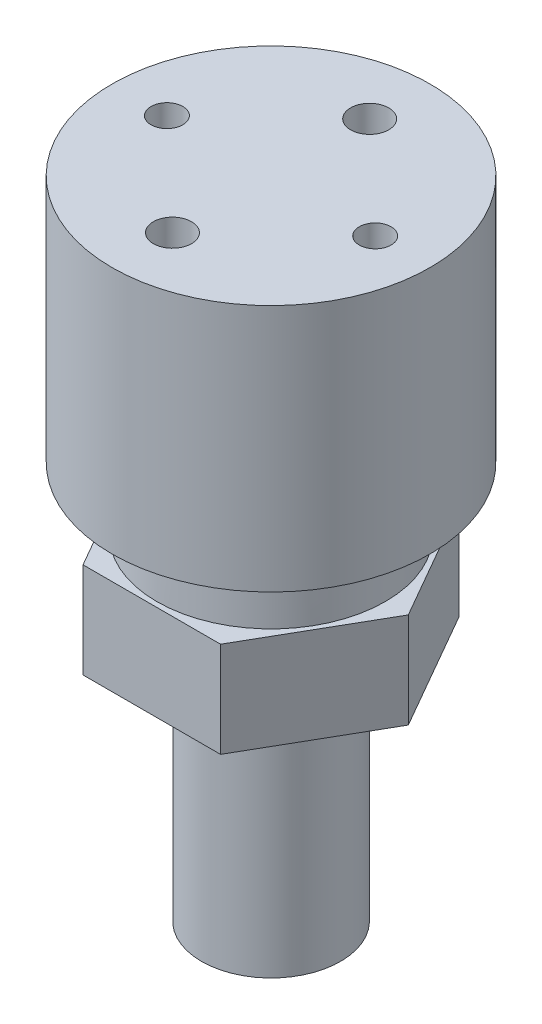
SolidWorks part; units mm, degrees
ref_plane "Front" through (0, 0, 0) normal (0, 0, 1) x (1, 0, 0)
ref_plane "Top" through (0, 0, 0) normal (0, 1, 0) x (1, 0, 0)
ref_plane "Right" through (0, 0, 0) normal (1, 0, 0) x (0, 0, -1)
sketch "Sketch1" plane through (0, 0, 0) normal (0, 0, 1) x (1, 0, 0)
  line L0 (0, 55.7282) -> (0, -38.7212) construction
  line L1 (0, 0) -> (-9.1249, 0)
  line L2 (-9.015, 5.0788) -> (-9.1249, 0)
  line L3 (-9.015, 5.0788) -> (-12.7, 5.0788)
  line L4 (-12.7, 5.0788) -> (-12.7, 24.8908)
  line L5 (-12.7, 24.8908) -> (0, 24.8908)
  line L6 (0, 24.8908) -> (0, 0)
  dimension "D1" = 25.4
  dimension "D2" = 5.08
  dimension "D4" = 19.812
  dimension "D5" = 18.03
revolve "Revolve1" add sketch "Sketch1" angle 360 about L0
sketch "Sketch2" plane through (0, 24.8908, 0) normal (0, 1, 0) x (-1, 0, 0)
  line L1 (0, 0) -> (0, 7.874) construction
  circle A0 centre (0, 7.874) radius 1.524
  dimension "D2" = 3.048
  dimension "D1" = 7.874
sketch "Sketch4" plane through (0, 24.8908, 0) normal (0, 1, 0) x (-1, 0, 0)
  line L0 (-16.6338, 0) -> (0, 0) construction
  circle A0 centre (-8.3169, 0) radius 1.27
  dimension "D1" = 2.54
  dimension "D2" = 8.3169
extrude "Cut-Extrude1" cut sketch "Sketch2" against normal blind 12.7
extrude "Cut-Extrude2" cut sketch "Sketch4" against normal blind 12.7
mirror "Mirror1" about plane through (0, 0, 0) normal (0, 0, 1) of "Cut-Extrude1"
sketch "Sketch5" plane through (0, 0, 0) normal (0, -1, 0) x (1, 0, 0)
  line L0 (0, 0) -> (0, 5.3395) construction
  line L1 (0, 0) -> (3.6523, 0) construction
  line L2 (10.9608, 0) -> (5.4917, 9.525)
  line L3 (5.4917, 9.525) -> (-5.4917, 9.525)
  line L4 (5.4917, -9.525) -> (-5.4917, -9.525)
  line L5 (10.9608, 0) -> (5.4917, -9.525)
  line L6 (-10.9608, 0) -> (-5.4917, -9.525)
  line L7 (-10.9608, 0) -> (-5.4917, 9.525)
  point P11 (0, -9.525)
  point P12 (0, 9.525)
  dimension "D1" = 19.05
extrude "Extrude1" add sketch "Sketch5" along normal blind 7.62
sketch "Sketch6" plane through (0, -7.62, 0) normal (0, -1, 0) x (1, 0, 0)
  circle A0 centre (0, 0) radius 5.5562
  dimension "D1" = 11.1125
extrude "Extrude2" add sketch "Sketch6" along normal blind 19.05
mirror "Mirror2" about plane through (0, 0, 0) normal (1, 0, 0) of "Cut-Extrude2"
